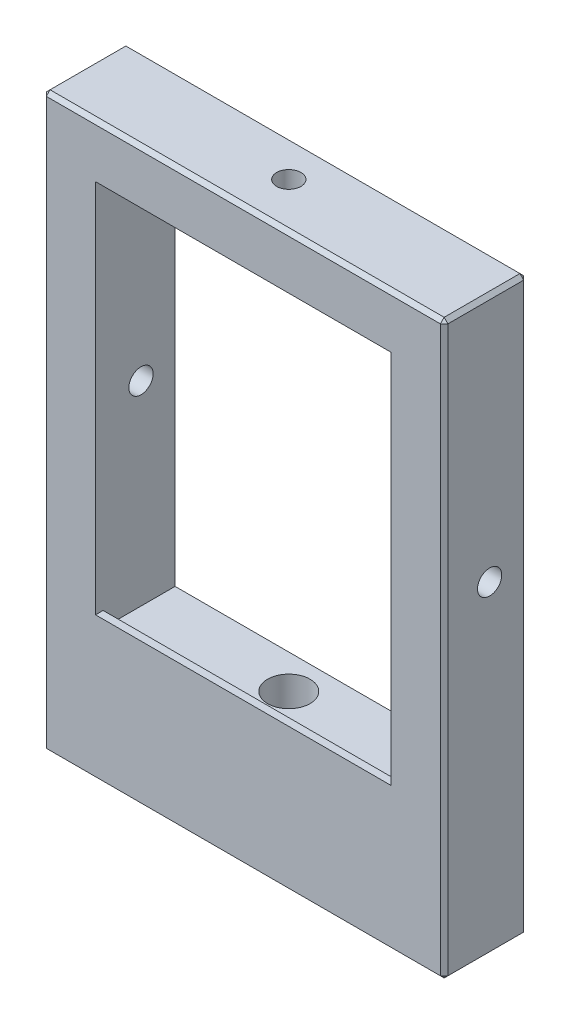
SolidWorks part; units mm, degrees
ref_plane "Front Plane" through (0, 0, 0) normal (0, 0, 1) x (1, 0, 0)
ref_plane "Top Plane" through (0, 0, 0) normal (0, 1, 0) x (1, 0, 0)
ref_plane "Right Plane" through (0, 0, 0) normal (1, 0, 0) x (0, 0, -1)
sketch "Sketch1" plane through (0, 0, 0) normal (0, 0, 1) x (1, 0, 0)
  line L1 (-17.5, -23.75) -> (17.5, -23.75) construction
  line L2 (-17.5, -23.75) -> (-17.5, 23.75) construction
  line L3 (-17.5, 23.75) -> (17.5, 23.75) construction
  line L4 (17.5, -23.75) -> (17.5, 23.75) construction
  line L5 (-17.5, -23.75) -> (17.5, 23.75) construction
  line L6 (-17.5, 23.75) -> (17.5, -23.75) construction
  line L7 (-19.5, -25.75) -> (19.5, -25.75)
  line L8 (-19.5, -25.75) -> (-19.5, 25.75)
  line L9 (-19.5, 25.75) -> (19.5, 25.75)
  line L10 (19.5, -25.75) -> (19.5, 25.75)
  line L11 (-19.5, -25.75) -> (19.5, 25.75) construction
  line L12 (-19.5, 25.75) -> (19.5, -25.75) construction
  line L13 (-26.5, -32.75) -> (26.5, -32.75)
  line L14 (-26.5, -32.75) -> (-26.5, 32.75)
  line L15 (-26.5, 32.75) -> (26.5, 32.75)
  line L16 (26.5, -32.75) -> (26.5, 32.75)
  line L17 (-26.5, -32.75) -> (26.5, 32.75) construction
  line L18 (-26.5, 32.75) -> (26.5, -32.75) construction
  point P0 (0, 0)
  point P6 (0, 0)
  point P11 (0, 0)
  dimension "D1" = 47.5
  dimension "D2" = 35
  dimension "D3" = 2
  dimension "D4" = 2
  dimension "D5" = 7
  dimension "D6" = 7
extrude "Boss-Extrude1" add sketch "Sketch1" along normal blind 10
sketch "Sketch2" plane through (0, -32.75, 0) normal (0, -1, 0) x (1, 0, 0)
  line L4 (-26.5, 0) -> (26.5, 0)
  line L5 (26.5, 0) -> (26.5, 10)
  line L6 (26.5, 10) -> (-26.5, 10)
  line L7 (-26.5, 10) -> (-26.5, 0)
  line L8 (-26.5, 0) -> (26.5, 0)
  line L9 (26.5, 0) -> (26.5, 10)
  line L10 (26.5, 10) -> (-26.5, 10)
  line L11 (-26.5, 10) -> (-26.5, 0)
  dimension "D1" = 0
extrude "Boss-Extrude2" add sketch "Sketch2" along normal blind 10
hole_wizard "Tap Drill for M4 Threaded Insert Tap1" positions "Sketch3" profile "Sketch4" hole size "M4 Threaded Insert" standard "Threaded Inserts"
sketch "Sketch3" plane through (0, -42.75, 0) normal (0, -1, 0) x (-1, 0, 0)
  line L0 (26.5, 0) -> (-26.5, -10) construction
  line L2 (-26.5, 0) -> (26.5, -10) construction
  point P0 (0, -5)
  point P14 (0, 0)
  point P15 (0, -5)
sketch "Sketch4" plane through (0, -42.75, 5) normal (1, 0, 0) x (0, 0, -1)
  line L0 (0, 0) -> (0, 17)
  line L1 (0, 17) -> (2.8, 17)
  line L2 (2.8, 17) -> (2.8, 0)
  line L5 (2.8, 0) -> (0, 0)
  line L11 (0, -6.35) -> (0, 107.95) construction
  dimension "Thru Hole Dia." = 5.6
  dimension "Thru Hole Depth" = 17
hole_wizard "Tap Drill for M2 Threaded Insert Tap1" positions "Sketch5" profile "Sketch6" hole size "M2 Threaded Insert" standard "Threaded Inserts"
sketch "Sketch5" plane through (26.5, 0, 0) normal (1, 0, 0) x (0, 0, -1)
  line L0 (0, -25.75) -> (-10, 25.75) construction
  line L6 (-10, -25.75) -> (0, -25.75) construction
  line L7 (-10, -25.75) -> (0, -25.75) construction
  line L9 (-10, 25.75) -> (0, 25.75) construction
  line L10 (-10, 25.75) -> (0, 25.75) construction
  point P0 (-5, 0)
  point P8 (0, 0)
  point P9 (0, 0)
  point P10 (-4.6809, -27.7346)
  point P15 (0, 0)
  point P23 (0, -32.75)
  point P24 (-5.1767, -32.75)
  point P25 (0, 0)
  point P26 (0, 0)
  point P31 (0, 0)
  point P32 (-10.5161, 25.75)
sketch "Sketch6" plane through (26.5, 0, 5) normal (0, 1, 0) x (0, 0, -1)
  line L0 (0, 0) -> (0, 53)
  line L1 (0, 53) -> (1.6, 53)
  line L2 (1.6, 53) -> (1.6, 0)
  line L5 (1.6, 0) -> (0, 0)
  line L11 (0, -6.35) -> (0, 107.95) construction
  dimension "Thru Hole Dia." = 3.2
  dimension "Thru Hole Depth" = 53
hole_wizard "Tap Drill for M2 Threaded Insert Tap2" positions "Sketch7" profile "Sketch8" hole size "M2 Threaded Insert" standard "Threaded Inserts"
sketch "Sketch7" plane through (0, 32.75, 0) normal (0, 1, 0) x (1, 0, 0)
  line L0 (-26.5, -10) -> (26.5, 0) construction
  point P0 (0, -5)
  point P9 (0, 0)
sketch "Sketch8" plane through (0, 32.75, 5) normal (1, 0, 0) x (0, 0, 1)
  line L0 (0, 0) -> (0, 7)
  line L1 (0, 7) -> (1.6, 7)
  line L2 (1.6, 7) -> (1.6, 0)
  line L5 (1.6, 0) -> (0, 0)
  line L11 (0, -6.35) -> (0, 107.95) construction
  dimension "Thru Hole Dia." = 3.2
  dimension "Thru Hole Depth" = 7
sketch "Sketch10" plane through (0, 0, 10) normal (0, 0, 1) x (1, 0, 0)
  line L0 (19.5, -25.75) -> (19.5, 25.75) construction
  line L1 (-19.5, 25.75) -> (19.5, 25.75)
  line L2 (-19.5, 25.75) -> (-19.5, -23.75)
  line L3 (-19.5, -23.75) -> (19.5, -23.75)
  line L4 (26.5, -42.75) -> (26.5, 32.75)
  line L5 (26.5, 32.75) -> (-26.5, 32.75)
  line L6 (-26.5, 32.75) -> (-26.5, -42.75)
  line L7 (-26.5, -42.75) -> (26.5, -42.75)
  line L8 (26.5, -42.75) -> (26.5, 32.75)
  line L9 (26.5, 32.75) -> (-26.5, 32.75)
  line L10 (-26.5, 32.75) -> (-26.5, -42.75)
  line L11 (-26.5, -42.75) -> (26.5, -42.75)
  line L12 (19.5, 25.75) -> (19.5, -23.75)
  line L13 (-19.5, -25.75) -> (19.5, -25.75) construction
  dimension "D2" = 2
  dimension "D1" = 0
extrude "Boss-Extrude3" add sketch "Sketch10" along normal blind 1
chamfer "Chamfer1" distance 0.5 angle 45 16 edges at (26.5, -42.75, 5.5) (0, -42.75, 0) (26.5, -5, 0) (-26.5, -5, 0) (0, 32.75, 0) (26.5, 32.75, 5.5) (-26.5, 32.75, 5.5) (-26.5, -42.75, 5.5) (26.5, -5, 11) (0, -42.75, 11) (0, 32.75, 11) (-26.5, -5, 11) (-19.5, 0, 0) (0, 25.75, 0) (19.5, 0, 0) (0, -25.75, 0)
